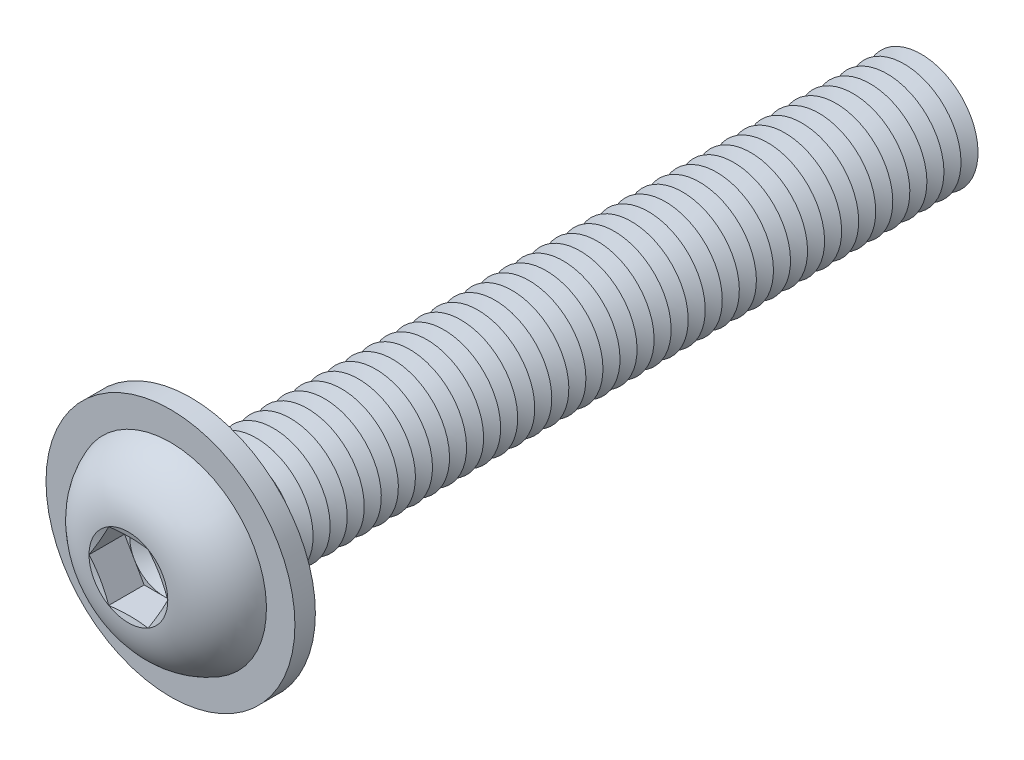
SolidWorks part; units mm, degrees
ref_plane "Front Plane" through (0, 0, 0) normal (0, 0, 1) x (1, 0, 0)
ref_plane "Top Plane" through (0, 0, 0) normal (0, 1, 0) x (1, 0, 0)
ref_plane "Right Plane" through (0, 0, 0) normal (1, 0, 0) x (0, 0, -1)
sketch "Sketch1" plane through (0, 0, 0) normal (1, 0, 0) x (0, 0, -1)
  line L0 (0, 5) -> (0, 8.75)
  line L3 (0, 5) -> (65, 5)
  line L4 (65, 5) -> (65, 0)
  line L5 (65, 0) -> (-5.5, 0) construction
  line L6 (-5.5, 0) -> (65, 0)
  line L7 (-5.5, 3.4641) -> (-5.5, 1.732) construction
  line L8 (-5.5, 1.732) -> (-5.5, 0)
  line L9 (-5.5, 3.4641) -> (-5.0359, 1.732)
  line L10 (-5.0359, 1.732) -> (-5.5, 1.732)
  line L11 (65, 0) -> (22.7481, 0) construction
  line L12 (0, 8.75) -> (-5.5, 8.75) construction
  arc A1 (0, 8.75) -> (-5.5, 3.4641) centre (0, 3.2457) ccw
  point P8 (65, 2.5)
  dimension "D1" = 17.5
  dimension "D2" = 10
  dimension "D3" = 5.5
  dimension "D4" = 6.9282
  dimension "D5" = 65
  dimension "D6" = 15
revolve "Revolve1" add sketch "Sketch1" angle 360 about L5
fillet "Fillet1" radius 0.75 1 edges at (0, 5, 0)
sketch "Sketch2" plane through (0, 0, 0) normal (1, 0, 0) x (0, 0, -1)
  line L0 (64.25, 5) -> (65.75, 5)
  line L1 (65, 5) -> (0.75, 5) construction
  line L2 (65.75, 5) -> (65, 3.701)
  line L3 (65, -5) -> (65, 5) construction
  line L4 (65, 3.701) -> (64.25, 5)
  dimension "D1" = 1.5
revolve "Cut-Revolve1" cut sketch "Sketch2" angle 360 about axis through (0, 0, -65) along (0, 0, -1)
pattern_linear "LPattern1" count 43 spacing 1.5 along (0, 0, 1) of "Cut-Revolve1"
sketch "Sketch3" plane through (0, 0, 5.5) normal (0, 0, 1) x (1, 0, 0)
  line L7 (1.732, 3) -> (-1.7321, 3)
  line L8 (-1.7321, 3) -> (-3.4641, 0)
  line L9 (-3.4641, 0) -> (-1.732, -3)
  line L10 (-1.732, -3) -> (1.732, -3)
  line L11 (1.732, -3) -> (3.4641, 0)
  line L12 (3.4641, 0) -> (1.732, 3)
  circle A0 centre (0, 0) radius 3 construction
  circle A3 centre (0, 0) radius 3.4641 construction
extrude "Cut-Extrude1" cut sketch "Sketch3" against normal blind 3.12
sketch "Sketch4" plane through (0, 0, 2.38) normal (0, 0, 1) x (1, 0, 0)
  line L1 (1.732, 3) -> (-1.7321, 3) construction
  circle A0 centre (0, 0) radius 3
extrude "Cut-Extrude2" cut sketch "Sketch4" against normal through all draft 60
sketch "Sketch5" plane through (0, 0, 0) normal (0, 0, -1) x (-1, 0, 0)
  circle A0 centre (0, 0) radius 10.95
  circle A1 centre (0, 0) radius 5.75
  circle A2 centre (0, 0) radius 5.75 construction
  dimension "D1" = 21.9
extrude "Boss-Extrude1" add sketch "Sketch5" against normal blind 1.8
